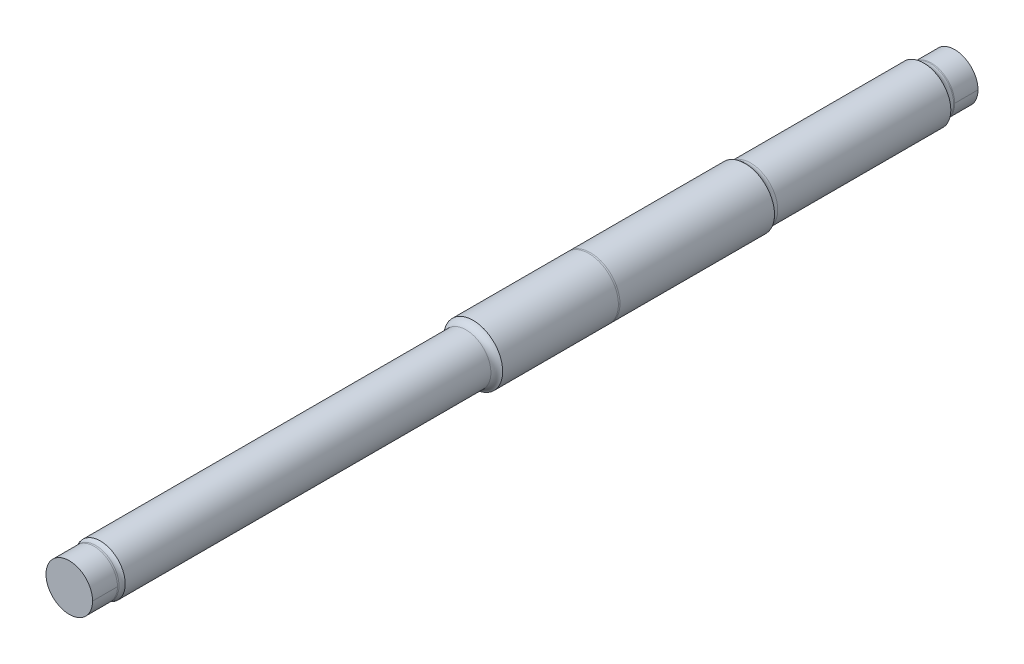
SolidWorks part; units mm, degrees
ref_plane "Alzado" through (0, 0, 0) normal (0, 0, 1) x (1, 0, 0)
ref_plane "Planta" through (0, 0, 0) normal (0, 1, 0) x (1, 0, 0)
ref_plane "Vista lateral" through (0, 0, 0) normal (1, 0, 0) x (0, 0, -1)
sketch "Croquis1" plane through (0, 0, 0) normal (1, 0, 0) x (0, 0, -1)
  line L0 (-285, 0) -> (-285, 15)
  line L1 (-285, 15) -> (-265, 15)
  line L2 (-265, 15) -> (-265, 16)
  line L3 (-265, 16) -> (-25, 16)
  line L4 (-25, 16) -> (-25, 19)
  line L5 (-25, 19) -> (150, 19)
  line L6 (150, 19) -> (150, 17.5)
  line L7 (150, 17.5) -> (265, 17.5)
  line L8 (265, 17.5) -> (265, 15)
  line L9 (265, 15) -> (285, 15)
  line L10 (285, 15) -> (285, 0)
  line L11 (285, 0) -> (-285, 0)
  point P14 (275, 15)
  dimension "D1" = 15
  dimension "D2" = 16
  dimension "D3" = 19
  dimension "D4" = 17.5
  dimension "D5" = 15
  dimension "D7" = 20
  dimension "D8" = 240
  dimension "D9" = 175
  dimension "D11" = 20
  dimension "D12" = 115
revolve "Revolución1" add sketch "Croquis1" angle 360 about L11
fillet "Redondeo1" radius 5 4 edges at (0, 15, -265) (0, 17.5, -150) (0, 16, 25) (0, 15, 265)
ref_plane "Plano1" through (0, 0, 269) normal (0, 0, 1) x (1, 0, 0)
ref_plane "Plano2" through (0, 0, -270) normal (0, 0, 1) x (1, 0, 0)
ref_plane "Plano3" through (0, 0, -49.5) normal (0, 0, 1) x (1, 0, 0)
ref_plane "Plano4" through (0, 0, -50.5) normal (0, 0, 1) x (1, 0, 0)
